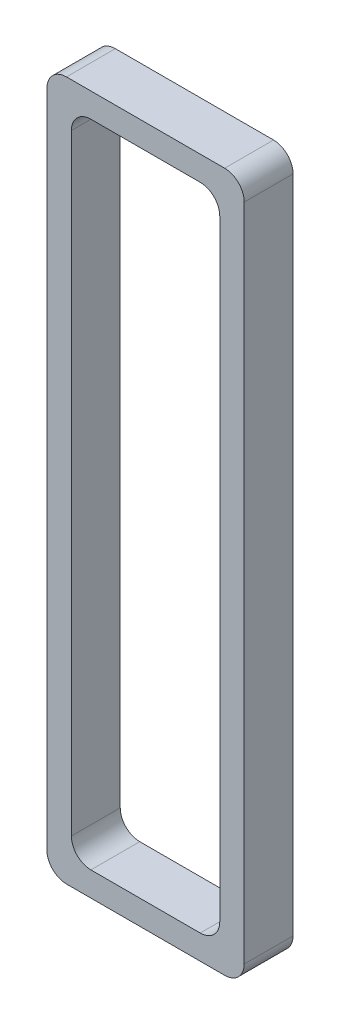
SolidWorks part; units mm, degrees
ref_plane "Front Plane" through (0, 0, 0) normal (0, 0, 1) x (1, 0, 0)
ref_plane "Top Plane" through (0, 0, 0) normal (0, 1, 0) x (1, 0, 0)
ref_plane "Right Plane" through (0, 0, 0) normal (1, 0, 0) x (0, 0, -1)
sketch "Sketch1" plane through (0, 0, 0) normal (0, 0, 1) x (1, 0, 0)
  line L0 (2.54, 14.605) -> (23.0899, 14.605)
  line L1 (25.6299, 12.065) -> (25.6299, -73.66)
  line L2 (23.0899, -76.2) -> (2.54, -76.2)
  line L3 (0, -73.66) -> (0, 12.065)
  line L4 (5.715, 11.43) -> (19.9149, 11.43)
  line L5 (22.4549, 8.89) -> (22.4549, -70.485)
  line L6 (19.9149, -73.025) -> (5.715, -73.025)
  line L7 (3.175, -70.485) -> (3.175, 8.89)
  line L8 (0, 14.605) -> (25.6299, 14.605) construction
  line L9 (25.6299, 14.605) -> (25.6299, -76.2) construction
  line L10 (3.175, 11.43) -> (22.4549, 11.43) construction
  line L11 (22.4549, 11.43) -> (22.4549, -73.025) construction
  line L12 (25.6299, -76.2) -> (0, -76.2) construction
  line L13 (22.4549, -73.025) -> (3.175, -73.025) construction
  line L14 (3.175, -73.025) -> (3.175, 11.43) construction
  line L15 (0, -76.2) -> (0, 14.605) construction
  arc A0 (23.0899, 14.605) -> (25.6299, 12.065) centre (23.0899, 12.065) cw
  arc A1 (19.9149, 11.43) -> (22.4549, 8.89) centre (19.9149, 8.89) cw
  arc A2 (25.6299, -73.66) -> (23.0899, -76.2) centre (23.0899, -73.66) cw
  arc A3 (22.4549, -70.485) -> (19.9149, -73.025) centre (19.9149, -70.485) cw
  arc A4 (5.715, -73.025) -> (3.175, -70.485) centre (5.715, -70.485) cw
  arc A5 (2.54, -76.2) -> (0, -73.66) centre (2.54, -73.66) cw
  arc A6 (2.54, 14.605) -> (0, 12.065) centre (2.54, 12.065) ccw
  arc A7 (5.715, 11.43) -> (3.175, 8.89) centre (5.715, 8.89) ccw
  dimension "D1" = 3.175
  dimension "D2" = 2.54
  dimension "D3" = 79.375
extrude "Extrude1" add sketch "Sketch1" along normal blind 6.35
